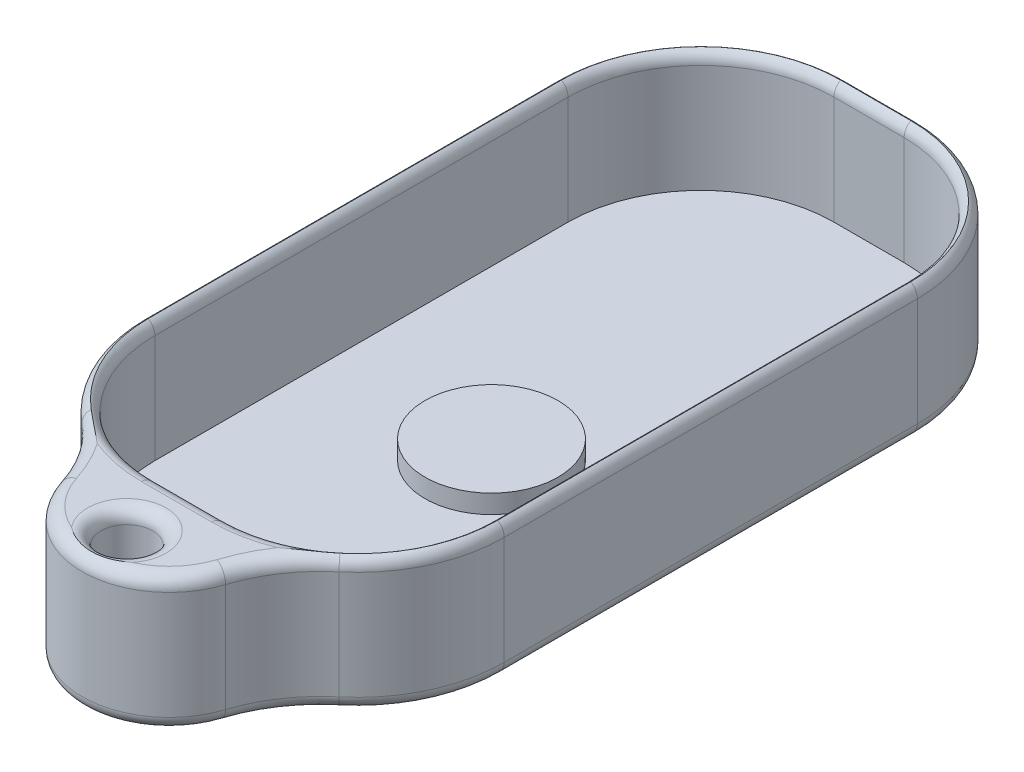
SolidWorks part; units mm, degrees
ref_plane "Front Plane" through (0, 0, 0) normal (0, 0, 1) x (1, 0, 0)
ref_plane "Top Plane" through (0, 0, 0) normal (0, 1, 0) x (1, 0, 0)
ref_plane "Right Plane" through (0, 0, 0) normal (1, 0, 0) x (0, 0, -1)
sketch "Sketch1" plane through (0, 0, 0) normal (0, 1, 0) x (1, 0, 0)
  line L0 (-1.27, 12.7) -> (-1.27, 52.1716)
  line L1 (12.7, 0) -> (19.4056, 0)
  line L2 (0, 12.7) -> (0, 52.1716)
  line L3 (12.7, 64.8716) -> (19.4056, 64.8716)
  line L4 (32.1056, 12.7) -> (32.1056, 52.1716)
  line L9 (12.7, 66.1416) -> (19.4056, 66.1416)
  line L10 (33.3756, 12.7) -> (33.3756, 52.1716)
  arc A0 (12.7, 0) -> (0, 12.7) centre (12.7, 12.7) cw
  arc A1 (19.4056, 0) -> (32.1056, 12.7) centre (19.4056, 12.7) ccw
  arc A2 (19.4056, 64.8716) -> (32.1056, 52.1716) centre (19.4056, 52.1716) cw
  arc A3 (0, 52.1716) -> (12.7, 64.8716) centre (12.7, 52.1716) cw
  arc A13 (-1.27, 52.1716) -> (12.7, 66.1416) centre (12.7, 52.1716) cw
  arc A14 (19.4056, 66.1416) -> (33.3756, 52.1716) centre (19.4056, 52.1716) cw
  arc A15 (28.3399, 1.9604) -> (33.3756, 12.7) centre (19.4056, 12.7) ccw
  arc A16 (23.9699, -4.518) -> (28.3399, 1.9604) centre (37.2741, -8.7793) cw
  arc A17 (8.1204, -4.5123) -> (23.9699, -4.518) centre (16.0461, -1.9801) ccw
  arc A18 (8.1204, -4.5123) -> (3.7566, 1.968) centre (-5.1868, -8.764) ccw
  arc A19 (3.7566, 1.968) -> (-1.27, 12.7) centre (12.7, 12.7) cw
  point P7 (0, 0)
  point P10 (32.1056, 0)
  point P13 (32.1056, 64.8716)
  point P16 (0, 64.8716)
  dimension "D3" = 12.7
  dimension "D1" = 64.8716
  dimension "D2" = 32.1056
extrude "Boss-Extrude1" add sketch "Sketch1" along normal blind 11.6078
sketch "Sketch5" plane through (0, 0, 0) normal (0, -1, 0) x (1, 0, 0)
  line L0 (19.4056, -66.1416) -> (12.7, -66.1416) construction
  line L1 (-1.27, -52.1716) -> (-1.27, -12.7) construction
  line L2 (33.3756, -12.7) -> (33.3756, -52.1716) construction
  line L3 (19.4056, -66.1416) -> (12.7, -66.1416)
  line L4 (-1.27, -52.1716) -> (-1.27, -12.7)
  line L5 (33.3756, -12.7) -> (33.3756, -52.1716)
  arc A0 (19.4056, -66.1416) -> (33.3756, -52.1716) centre (19.4056, -52.1716) ccw construction
  arc A1 (-1.27, -52.1716) -> (12.7, -66.1416) centre (12.7, -52.1716) ccw construction
  arc A2 (3.7566, -1.968) -> (-1.27, -12.7) centre (12.7, -12.7) ccw construction
  arc A3 (3.7566, -1.968) -> (8.1204, 4.5123) centre (-5.1868, 8.764) ccw construction
  arc A4 (23.9699, 4.518) -> (8.1204, 4.5123) centre (16.0461, 1.9801) ccw construction
  arc A5 (23.9699, 4.518) -> (28.3399, -1.9604) centre (37.2741, 8.7793) ccw construction
  arc A6 (33.3756, -12.7) -> (28.3399, -1.9604) centre (19.4056, -12.7) ccw construction
  arc A7 (19.4056, -66.1416) -> (33.3756, -52.1716) centre (19.4056, -52.1716) ccw
  arc A8 (-1.27, -52.1716) -> (12.7, -66.1416) centre (12.7, -52.1716) ccw
  arc A9 (3.7566, -1.968) -> (-1.27, -12.7) centre (12.7, -12.7) ccw
  arc A10 (3.7566, -1.968) -> (8.1204, 4.5123) centre (-5.1868, 8.764) ccw
  arc A11 (23.9699, 4.518) -> (8.1204, 4.5123) centre (16.0461, 1.9801) ccw
  arc A12 (23.9699, 4.518) -> (28.3399, -1.9604) centre (37.2741, 8.7793) ccw
  arc A13 (33.3756, -12.7) -> (28.3399, -1.9604) centre (19.4056, -12.7) ccw
extrude "Boss-Extrude2" add sketch "Sketch5" along normal blind 1.27
sketch "Sketch6" plane through (0, 11.6078, 0) normal (0, 1, 0) x (1, 0, 0)
  circle A0 centre (16.0461, -6.0254) radius 2.4772
extrude "Cut-Extrude1" cut sketch "Sketch6" against normal through all
sketch "Sketch7" plane through (0, -1.27, 0) normal (0, -1, 0) x (1, 0, 0)
  line L0 (12.7, -66.1416) -> (19.4056, -66.1416) construction
  circle A0 centre (16.0528, -28.8036) radius 6.35
  dimension "D1" = 37.338
extrude "Boss-Extrude3" add sketch "Sketch7" against normal blind 3.048
fillet "Fillet3" radius 1.27 30 edges at (16.0528, 11.6078, 0) (28.3859, 11.6078, -3.7197) (32.1056, 11.6078, -32.4358) (28.3859, 11.6078, -61.1519) (16.0528, 11.6078, -64.8716) (3.7197, 11.6078, -61.1519) (0, 11.6078, -32.4358) (3.7197, 11.6078, -3.7197) (-1.27, 11.6078, -32.4358) (2.8217, 11.6078, -62.0499) (16.0528, 11.6078, -66.1416) (29.2839, 11.6078, -62.0499) (33.3756, 11.6078, -32.4358) (32.0542, 11.6078, -6.7692) (25.6927, 11.6078, 0.967) (16.0431, 11.6078, 10.3004) (6.4007, 11.6078, 0.9609) (0.0489, 11.6078, -6.7746) (16.0461, 11.6078, 8.5026) (16.0528, -1.27, -66.1416) (2.8217, -1.27, -62.0499) (-1.27, -1.27, -32.4358) (0.0489, -1.27, -6.7746) (6.4007, -1.27, 0.9609) (16.0431, -1.27, 10.3004) (25.6927, -1.27, 0.967) (32.0542, -1.27, -6.7692) (33.3756, -1.27, -32.4358) (29.2839, -1.27, -62.0499) (16.0461, -1.27, 8.5026)
